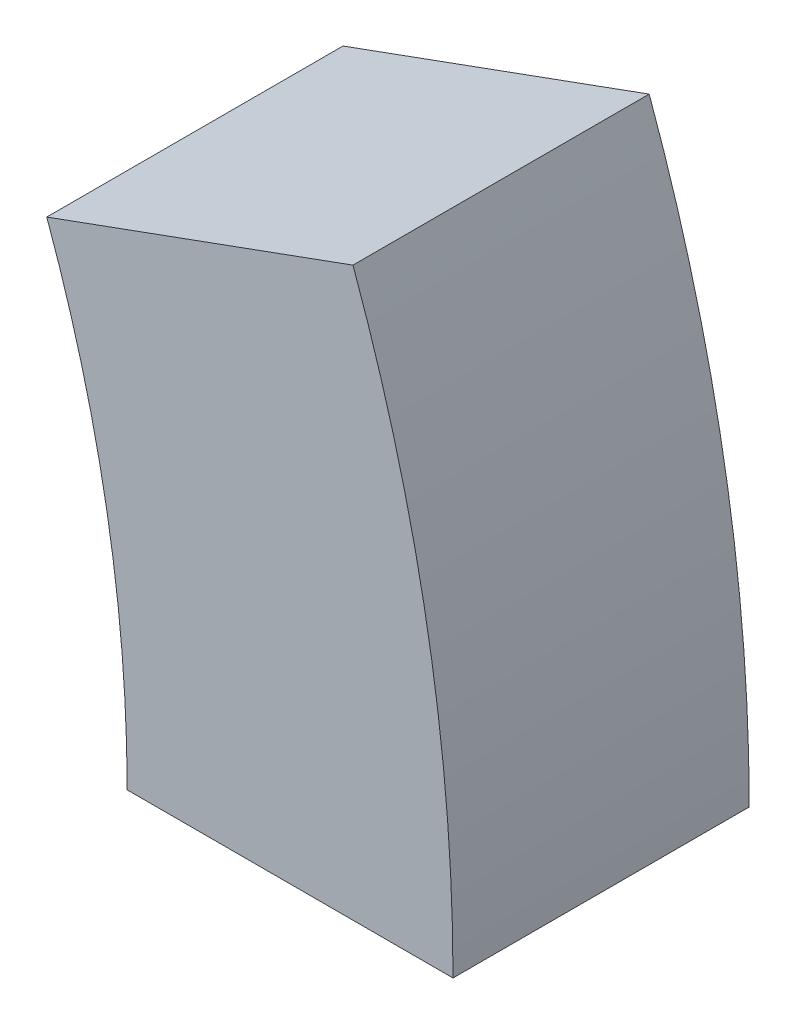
SolidWorks part; units mm, degrees
ref_plane "Plan de face" through (0, 0, 0) normal (0, 0, 1) x (1, 0, 0)
ref_plane "Plan de dessus" through (0, 0, 0) normal (0, 1, 0) x (1, 0, 0)
ref_plane "Plan de droite" through (0, 0, 0) normal (1, 0, 0) x (0, 0, -1)
sketch "Esquisse1" plane through (0, 0, 0) normal (0, 0, 1) x (1, 0, 0)
  line L0 (0, 0) -> (470.6608, 0) construction
  line L1 (0, -55.3377) -> (0, 353.7921) construction
  line L2 (0, 0) -> (442.2765, 160.9755) construction
  line L3 (0, 0) -> (360.5471, 302.5349) construction
  line L4 (0, 0) -> (235.3304, 407.6042) construction
  line L5 (0, 0) -> (81.7294, 463.5104) construction
  line L6 (0, 0) -> (-81.7294, 463.5104) construction
  line L7 (0, 0) -> (-235.3304, 407.6042) construction
  line L8 (0, 0) -> (-360.5471, 302.5349) construction
  line L9 (0, 0) -> (-442.2765, 160.9755) construction
  line L10 (0, 0) -> (-470.6608, 0) construction
  line L11 (-390.3547, -30) -> (366.2536, -30) construction
  line L12 (-390.3547, 30) -> (366.2536, 30) construction
  line L13 (-390.3547, 60) -> (366.2536, 60) construction
  line L14 (22.5, -55.3377) -> (22.5, 160.9755) construction
  line L15 (366.2536, 90) -> (-390.3547, 90) construction
  line L16 (45, -55.3377) -> (45, 160.9755) construction
  line L17 (-390.3547, 120) -> (366.2536, 120) construction
  line L18 (-90, -59.8279) -> (-90, 0) construction
  line L19 (366.2536, 150) -> (-390.3547, 150) construction
  line L20 (67.5, -55.3377) -> (67.5, 160.9755) construction
  line L21 (90, -55.3377) -> (90, 160.9755) construction
  line L22 (112.5, -55.3377) -> (112.5, 160.9755) construction
  line L23 (135, -55.3377) -> (135, 160.9755) construction
  line L24 (157.5, -55.3377) -> (157.5, 160.9755) construction
  line L25 (180, -55.3377) -> (180, 160.9755) construction
  line L26 (202.5, -55.3377) -> (202.5, 160.9755) construction
  line L27 (225, -55.3377) -> (225, 160.9755) construction
  line L30 (90, 0) -> (112, 0)
  line L31 (84.5723, 30.7818) -> (105.2456, 38.3063)
  arc A0 (90, 0) -> (-90, 0) centre (0, 0) ccw construction
  arc A1 (112, 0) -> (-112, 0) centre (0, 0) ccw construction
  arc A2 (112, 0) -> (105.2456, 38.3063) centre (0, 0) ccw
  arc A3 (90, 0) -> (84.5723, 30.7818) centre (0, 0) ccw
extrude "Extrusion1" add sketch "Esquisse1" along normal blind 20
